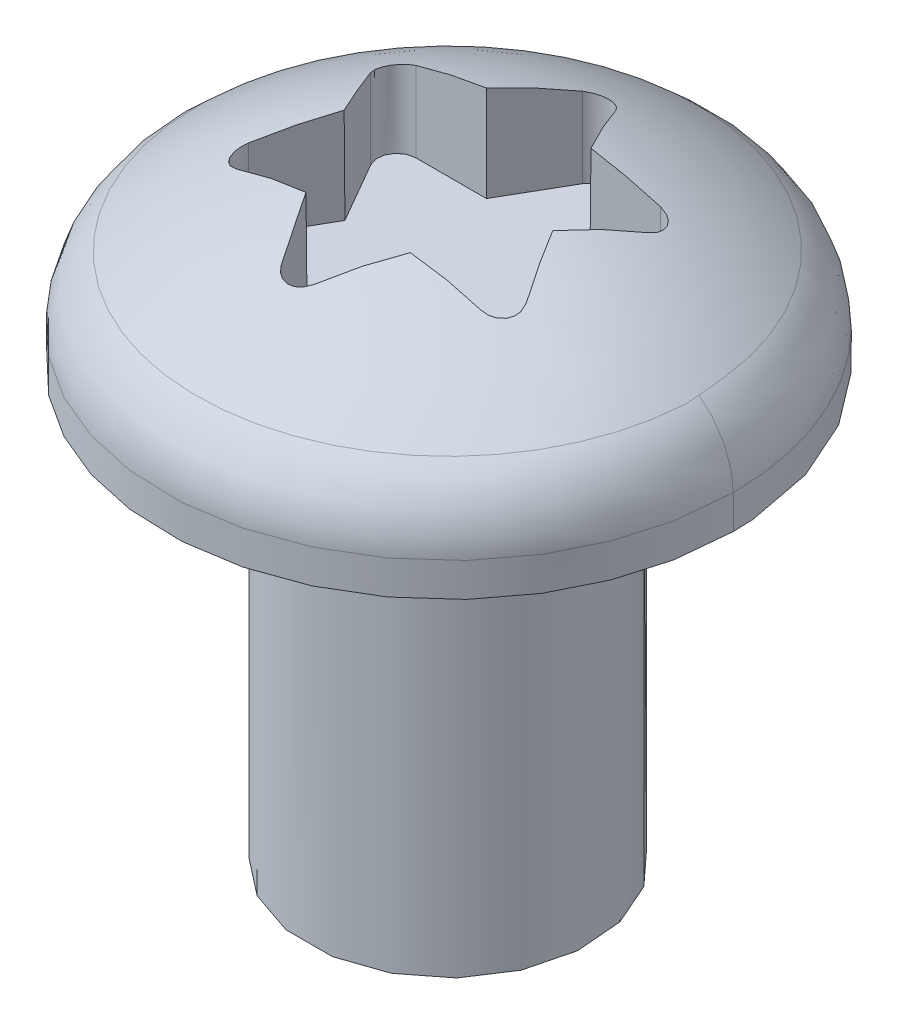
SolidWorks part; units mm, degrees
ref_plane "Front" through (0, 0, 0) normal (0, 0, 1) x (1, 0, 0)
ref_plane "Top" through (0, 0, 0) normal (0, 1, 0) x (1, 0, 0)
ref_plane "Right" through (0, 0, 0) normal (1, 0, 0) x (0, 0, -1)
imported_body "Imported1"
sketch "Sketch1" plane through (0, -7.3398, 0) normal (0, -1, 0) x (1, 0, 0)
  circle A0 centre (-16.6259, -1.7079) radius 2.7738
  circle A2 centre (-16.6259, -1.7079) radius 1.5
extrude "Cut-Extrude1" cut sketch "Sketch1" against normal up to surface (5.17 mm away)
sketch "Sketch2" plane through (0, -7.3398, 0) normal (0, -1, 0) x (1, 0, 0)
  circle A0 centre (-16.6259, -1.7079) radius 1.7
extrude "Boss-Extrude2" add sketch "Sketch2" against normal up to surface (5.17 mm away)
